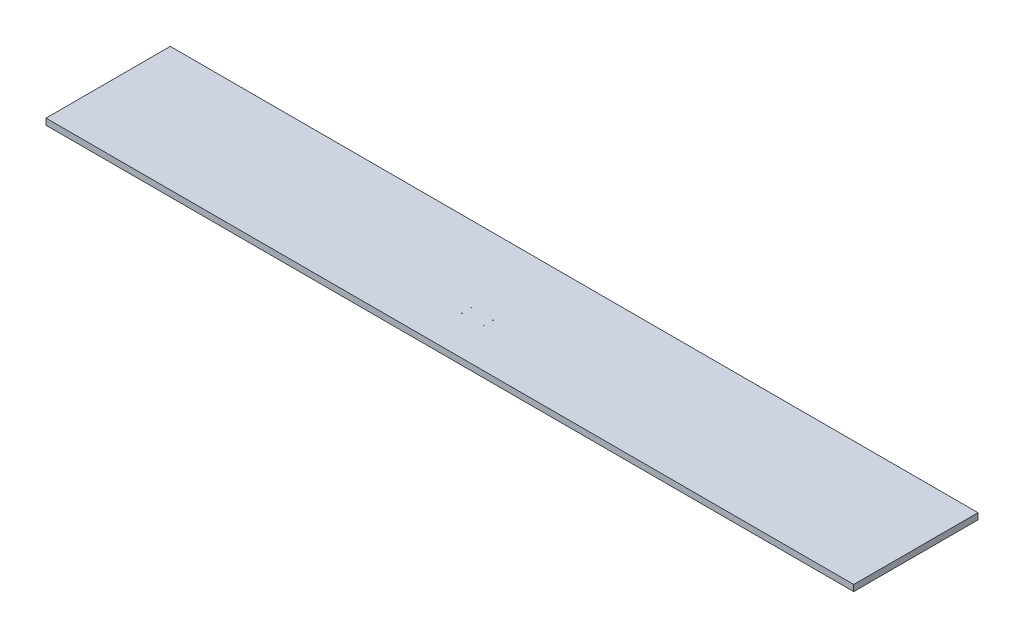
SolidWorks part; units mm, degrees
ref_plane "Plan de face" through (0, 0, 0) normal (0, 0, 1) x (1, 0, 0)
ref_plane "Plan de dessus" through (0, 0, 0) normal (0, 1, 0) x (1, 0, 0)
ref_plane "Plan de droite" through (0, 0, 0) normal (1, 0, 0) x (0, 0, -1)
sketch "Esquisse1" plane through (0, 0, 0) normal (0, 1, 0) x (1, 0, 0)
  line L1 (-6500, 1000) -> (6500, 1000)
  line L2 (-6500, 1000) -> (-6500, -1000)
  line L3 (-6500, -1000) -> (6500, -1000)
  line L4 (6500, 1000) -> (6500, -1000)
  line L5 (-6500, 1000) -> (6500, -1000) construction
  line L6 (-6500, -1000) -> (6500, 1000) construction
  point P0 (0, 0)
  dimension "D1" = 13000
  dimension "D2" = 2000
extrude "Boss.-Extru.1" add sketch "Esquisse1" against normal blind 100
sketch "Esquisse2" plane through (0, 0, 0) normal (0, 1, 0) x (1, 0, 0)
  line L0 (-435, -370) -> (-435, -220) construction
  line L1 (-435, -220) -> (-85, -220) construction
  line L2 (-85, -220) -> (-85, -370) construction
  line L3 (-85, -370) -> (-435, -370) construction
  circle A4 centre (-85, -220) radius 5
  circle A5 centre (-85, -370) radius 5
  circle A6 centre (-435, -220) radius 5
  circle A7 centre (-435, -370) radius 5
  dimension "D5" = 10
  dimension "D1" = 350
  dimension "D2" = 150
  dimension "D3" = 220
  dimension "D4" = 85
extrude "Enlèv. mat.-Extru.1" cut sketch "Esquisse2" against normal through all
